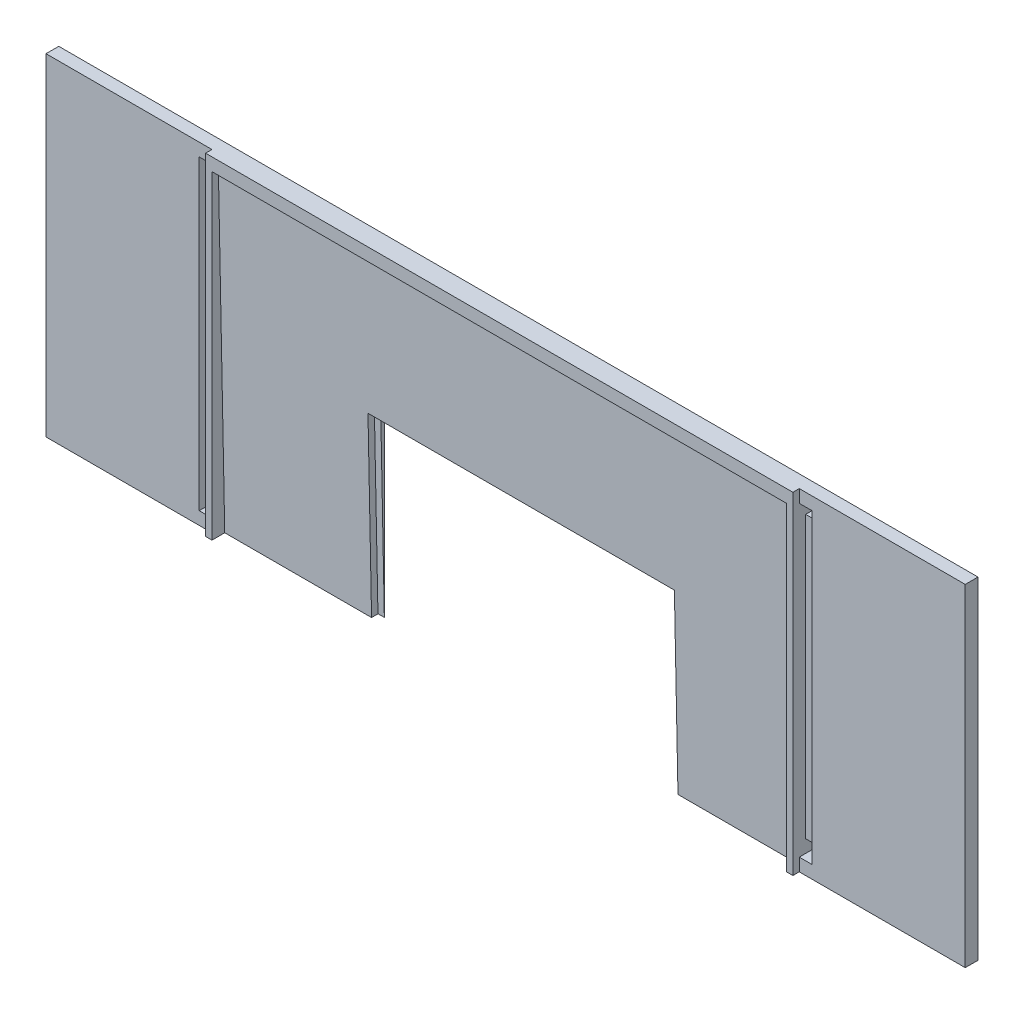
SolidWorks part; units mm, degrees
ref_plane "Front Plane" through (0, 0, 0) normal (0, 0, 1) x (1, 0, 0)
ref_plane "Top Plane" through (0, 0, 0) normal (0, 1, 0) x (1, 0, 0)
ref_plane "Right Plane" through (0, 0, 0) normal (1, 0, 0) x (0, 0, -1)
sketch "Sketch1" plane through (0, 0, 0) normal (0, 0, 1) x (1, 0, 0)
  line L0 (330.2, -330.2) -> (914.4, -330.2)
  line L1 (-914.4, -330.2) -> (-279.4, -330.2)
  line L2 (-914.4, -330.2) -> (-914.4, 330.2)
  line L3 (-914.4, 330.2) -> (914.4, 330.2)
  line L4 (914.4, -330.2) -> (914.4, 330.2)
  line L5 (-914.4, -330.2) -> (914.4, 330.2) construction
  line L6 (-914.4, 330.2) -> (914.4, -330.2) construction
  line L8 (-279.4, -330.2) -> (-279.4, 25.4)
  line L9 (-279.4, 25.4) -> (330.2, 25.4)
  line L10 (330.2, -330.2) -> (330.2, 25.4)
  point P0 (0, 0)
  dimension "D1" = 1828.8
  dimension "D2" = 660.4
  dimension "D3" = 355.6
  dimension "D4" = 584.2
  dimension "D5" = 635
extrude "Base" add sketch "Sketch1" against normal blind 25.4
sketch "Sketch2" plane through (0, 0, 0) normal (0, 0, 1) x (1, 0, 0)
  line L0 (-914.4, -330.2) -> (-279.4, -330.2) construction
  line L1 (-609.6, -304.8) -> (-584.2, -304.8)
  line L2 (-609.6, -304.8) -> (-609.6, 304.8)
  line L3 (-609.6, 304.8) -> (-584.2, 304.8)
  line L4 (-584.2, -304.8) -> (-584.2, 304.8)
  line L5 (-914.4, 330.2) -> (-914.4, -330.2) construction
  line L7 (330.2, -330.2) -> (914.4, -330.2) construction
  line L8 (584.2, 304.8) -> (609.6, 304.8)
  line L9 (584.2, 304.8) -> (584.2, -304.8)
  line L10 (584.2, -304.8) -> (609.6, -304.8)
  line L11 (609.6, 304.8) -> (609.6, -304.8)
  line L12 (914.4, -330.2) -> (914.4, 330.2) construction
  line L13 (914.4, 330.2) -> (-914.4, 330.2) construction
  dimension "D1" = 609.6
  dimension "D2" = 25.4
  dimension "D3" = 304.8
  dimension "D4" = 25.4
  dimension "D5" = 25.4
  dimension "D6" = 25.4
  dimension "D7" = 304.8
  dimension "D8" = 25.4
extrude "Hood Grooves" cut sketch "Sketch2" against normal blind 12.7
sketch "Sketch4" plane through (0, 0, 0) normal (0, 0, 1) x (1, 0, 0)
  line L0 (914.4, 330.2) -> (-914.4, 330.2) construction
  line L1 (-584.2, 330.2) -> (584.2, 330.2)
  line L2 (-584.2, 330.2) -> (-584.2, -330.2)
  line L3 (-584.2, -330.2) -> (-571.5, -330.2)
  line L4 (584.2, 330.2) -> (584.2, -330.2)
  line L5 (330.2, -330.2) -> (914.4, -330.2) construction
  line L6 (571.5, -330.2) -> (584.2, -330.2)
  line L7 (-571.5, 304.8) -> (571.5, 304.8)
  line L8 (-571.5, 304.8) -> (-571.5, -330.2)
  line L10 (571.5, 304.8) -> (571.5, -330.2)
  dimension "D1" = 12.7
  dimension "D2" = 12.7
extrude "Spill Guard" add sketch "Sketch4" along normal blind 12.7
ref_plane "Tilt Plane" through (-571.5, 0, 0) normal (1, 0, 0) x (0, 0, -1)
sketch "Sketch5" plane through (-571.5, 0, 0) normal (1, 0, 0) x (0, 0, -1)
  line L0 (0, -330.2) -> (12.7, -330.2)
  line L1 (25.4, -330.2) -> (0, -330.2) construction
  line L2 (12.7, -330.2) -> (0, 304.8)
  line L3 (0, 304.8) -> (0, -330.2)
extrude "Tilt Extrusion" cut sketch "Sketch5" along normal blind 1143
sketch "Sketch8" plane through (0, 0, -25.4) normal (0, 0, -1) x (-1, 0, 0)
  line L0 (-914.4, 330.2) -> (914.4, 330.2) construction
  line L1 (-609.6, 304.8) -> (-584.2, 304.8)
  line L2 (-609.6, 304.8) -> (-609.6, 279.4)
  line L3 (-609.6, 279.4) -> (-584.2, 279.4)
  line L4 (-584.2, 304.8) -> (-584.2, 279.4)
  line L5 (-914.4, -330.2) -> (-914.4, 330.2) construction
  line L6 (-330.2, -330.2) -> (-914.4, -330.2) construction
  line L7 (-609.6, -279.4) -> (-584.2, -279.4)
  line L8 (-609.6, -279.4) -> (-609.6, -304.8)
  line L9 (-609.6, -304.8) -> (-584.2, -304.8)
  line L10 (-584.2, -279.4) -> (-584.2, -304.8)
  line L11 (914.4, 330.2) -> (914.4, -330.2) construction
  line L12 (584.2, 304.8) -> (609.6, 304.8)
  line L13 (584.2, 304.8) -> (584.2, 279.4)
  line L14 (584.2, 279.4) -> (609.6, 279.4)
  line L15 (609.6, 304.8) -> (609.6, 279.4)
  line L16 (584.2, -279.4) -> (609.6, -279.4)
  line L17 (584.2, -279.4) -> (584.2, -304.8)
  line L18 (584.2, -304.8) -> (609.6, -304.8)
  line L19 (609.6, -279.4) -> (609.6, -304.8)
  dimension "D1" = 25.4
  dimension "D2" = 25.4
  dimension "D3" = 25.4
  dimension "D4" = 304.8
  dimension "D5" = 25.4
  dimension "D6" = 25.4
  dimension "D7" = 25.4
  dimension "D8" = 25.4
  dimension "D9" = 304.8
extrude "Cut-Extrude3" cut sketch "Sketch8" against normal blind 12.7
ref_plane "Plane2" through (0, 0.3758, -18.791) normal (0, -0.02, 0.9998) x (1, 0, 0)
ref_plane "Plane3" through (0, 0, -25.4) normal (0, 0, -1) x (-1, 0, 0)
sketch "Sketch10" plane through (0, 0.3758, -18.791) normal (0, -0.02, 0.9998) x (1, 0, 0)
  line L0 (317.5, -330.3879) -> (330.2, -330.3879)
  line L1 (-279.4, 25.2832) -> (330.2, 25.2832)
  line L2 (-279.4, 25.2832) -> (-279.4, -330.3879)
  line L3 (-279.4, -330.3879) -> (-266.7, -330.3879)
  line L4 (330.2, 25.2832) -> (330.2, -330.3879)
  line L5 (-266.7, 12.5832) -> (317.5, 12.5832)
  line L6 (-266.7, 12.5832) -> (-266.7, -330.3879)
  line L8 (317.5, 12.5832) -> (317.5, -330.3879)
  dimension "D1" = 12.7
  dimension "D2" = 12.7
  dimension "D3" = 12.7
extrude "Boss-Extrude1" add sketch "Sketch10" against normal up to surface (7.116 mm away)
